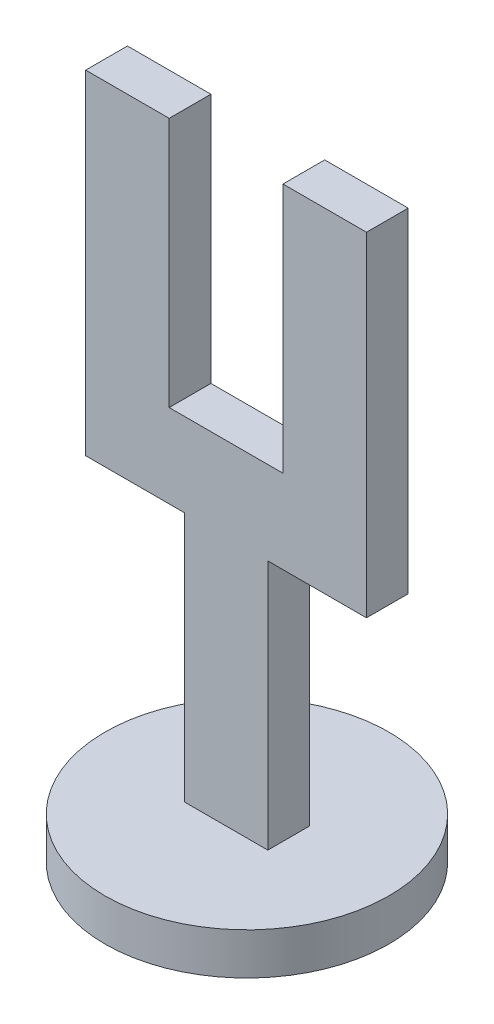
SolidWorks part; units mm, degrees
ref_plane "Front Plane" through (0, 0, 0) normal (0, 0, 1) x (1, 0, 0)
ref_plane "Top Plane" through (0, 0, 0) normal (0, 1, 0) x (1, 0, 0)
ref_plane "Right Plane" through (0, 0, 0) normal (1, 0, 0) x (0, 0, -1)
sketch "Sketch1" plane through (0, 0, 0) normal (0, 1, 0) x (1, 0, 0)
  circle A0 centre (0, 0) radius 17
  dimension "D1" = 34
extrude "Boss-Extrude1" add sketch "Sketch1" along normal blind 5
sketch "Sketch2" plane through (0, 0, 0) normal (0, -1, 0) x (1, 0, 0)
  circle A0 centre (0, 0) radius 15.5
  dimension "D1" = 31
extrude "Cut-Extrude1" cut sketch "Sketch2" against normal blind 2.5
sketch "Sketch3" plane through (0, 5, 0) normal (0, 1, 0) x (1, 0, 0)
  line L1 (-5, 2.5) -> (5, 2.5)
  line L2 (-5, 2.5) -> (-5, -2.5)
  line L3 (-5, -2.5) -> (5, -2.5)
  line L4 (5, 2.5) -> (5, -2.5)
  line L5 (-5, 2.5) -> (5, -2.5) construction
  line L6 (-5, -2.5) -> (5, 2.5) construction
  point P0 (0, 0)
  dimension "D1" = 10
  dimension "D2" = 5
extrude "Boss-Extrude2" add sketch "Sketch3" along normal blind 30
sketch "Sketch4" plane through (0, 35, 0) normal (0, 1, 0) x (1, 0, 0)
  line L0 (5, 2.5) -> (-5, 2.5) construction
  line L1 (16.8152, -2.5) -> (-16.8152, -2.5)
  line L2 (16.8152, -2.5) -> (16.8152, 2.5)
  line L3 (16.8152, 2.5) -> (-16.8152, 2.5)
  line L4 (-16.8152, -2.5) -> (-16.8152, 2.5)
  line L5 (16.8152, -2.5) -> (-16.8152, 2.5) construction
  line L6 (16.8152, 2.5) -> (-16.8152, -2.5) construction
  circle A0 centre (0, 0) radius 17 construction
  point P0 (0, 0)
extrude "Boss-Extrude3" add sketch "Sketch4" along normal blind 10
sketch "Sketch5" plane through (0, 45, 0) normal (0, 1, 0) x (1, 0, 0)
  line L0 (-16.8152, -2.5) -> (16.8152, -2.5) construction
  line L1 (16.8152, 2.5) -> (6.8152, 2.5)
  line L2 (16.8152, 2.5) -> (16.8152, -2.5)
  line L3 (16.8152, -2.5) -> (6.8152, -2.5)
  line L4 (6.8152, 2.5) -> (6.8152, -2.5)
  line L6 (-16.8152, 2.5) -> (-6.8152, 2.5)
  line L7 (-16.8152, 2.5) -> (-16.8152, -2.5)
  line L8 (-16.8152, -2.5) -> (-6.8152, -2.5)
  line L9 (-6.8152, 2.5) -> (-6.8152, -2.5)
  dimension "D1" = 10
extrude "Boss-Extrude4" add sketch "Sketch5" along normal blind 30
